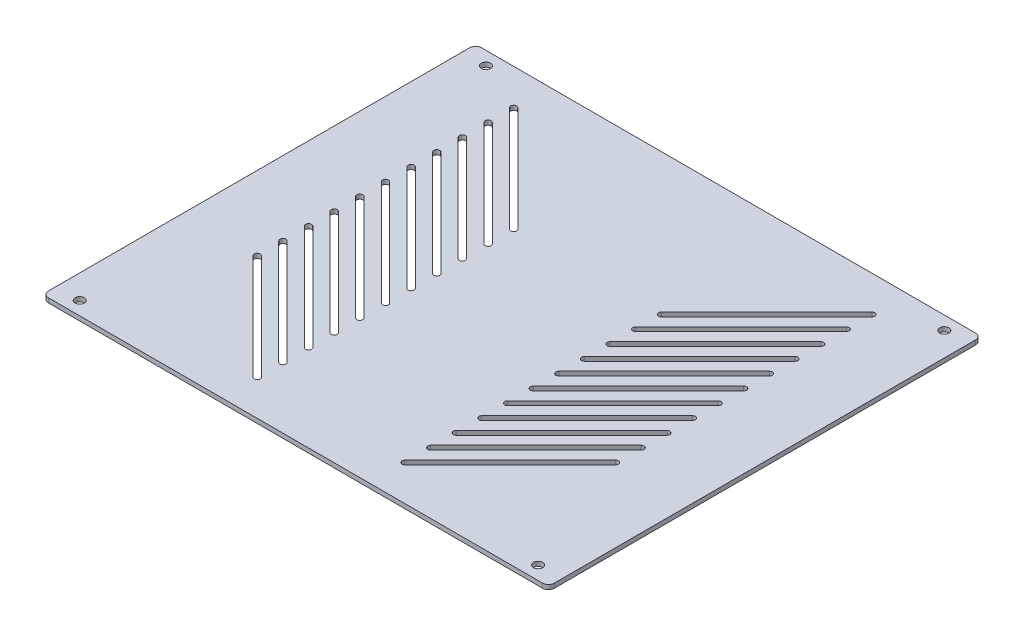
SolidWorks part; units mm, degrees
ref_plane "Front Plane" through (0, 0, 0) normal (0, 0, 1) x (1, 0, 0)
ref_plane "Top Plane" through (0, 0, 0) normal (0, 1, 0) x (1, 0, 0)
ref_plane "Right Plane" through (0, 0, 0) normal (1, 0, 0) x (0, 0, -1)
sketch "Sketch1" plane through (0, 0, 0) normal (0, 1, 0) x (1, 0, 0)
  line L1 (85, -72.75) -> (-85, -72.75)
  line L2 (85, -72.75) -> (85, 72.75)
  line L3 (85, 72.75) -> (-85, 72.75)
  line L4 (-85, -72.75) -> (-85, 72.75)
  line L5 (85, -72.75) -> (-85, 72.75) construction
  line L6 (85, 72.75) -> (-85, -72.75) construction
  line L7 (77, -68.25) -> (-77, -68.25) construction
  line L8 (77, -68.25) -> (77, 68.25) construction
  line L9 (77, 68.25) -> (-77, 68.25) construction
  line L10 (-77, -68.25) -> (-77, 68.25) construction
  line L11 (77, -68.25) -> (-77, 68.25) construction
  line L12 (77, 68.25) -> (-77, -68.25) construction
  circle A0 centre (-77, 68.25) radius 1.55
  circle A1 centre (77, 68.25) radius 1.55
  circle A2 centre (77, -68.25) radius 1.55
  circle A3 centre (-77, -68.25) radius 1.55
  point P0 (0, 0)
  point P5 (0, 0)
  dimension "D5" = 3.1
  dimension "D1" = 145.5
  dimension "D2" = 170
  dimension "D3" = 136.5
  dimension "D4" = 154
base flange "Base-Flange1" sketch "Sketch1" thickness 1.5 reverse thickness direction no parameters "D1"=1.65
fillet "Fillet1" radius 2 4 edges at (-85, -0.75, -72.75) (85, -0.75, -72.75) (-85, -0.75, 72.75) (85, -0.75, 72.75)
sketch "Sketch6" plane through (0, 0, 0) normal (0, 1, 0) x (1, 0, 0)
  line L0 (0, -72.75) -> (0, 72.75) construction
  line L1 (-83, -72.75) -> (83, -72.75) construction
  line L2 (83, 72.75) -> (-83, 72.75) construction
  line L3 (24.8223, -60.75) -> (60.1777, -25.3947) construction
  line L4 (0, -72.75) -> (85, -72.75) construction
  line L5 (85, -72.75) -> (85, 0) construction
  line L6 (85, -70.75) -> (85, 70.75) construction
  line L7 (25.5294, -61.4571) -> (60.8848, -26.1018)
  line L8 (24.1152, -60.0429) -> (59.4706, -24.6876)
  line L9 (25.5294, -52.8426) -> (60.8848, -17.4873)
  line L10 (24.1152, -51.4284) -> (59.4706, -16.0731)
  line L11 (24.8223, -52.1355) -> (60.1777, -16.7802) construction
  line L12 (25.5294, -44.2282) -> (60.8848, -8.8728)
  line L13 (24.1152, -42.814) -> (59.4706, -7.4586)
  line L14 (24.8223, -43.5211) -> (60.1777, -8.1657) construction
  line L15 (25.5294, -35.6137) -> (60.8848, -0.2584)
  line L16 (24.1152, -34.1995) -> (59.4706, 1.1558)
  line L17 (24.8223, -34.9066) -> (60.1777, 0.4487) construction
  line L18 (25.5294, -26.9992) -> (60.8848, 8.3561)
  line L19 (24.1152, -25.585) -> (59.4706, 9.7703)
  line L20 (24.8223, -26.2921) -> (60.1777, 9.0632) construction
  line L21 (25.5294, -18.3848) -> (60.8848, 16.9706)
  line L22 (24.1152, -16.9706) -> (59.4706, 18.3848)
  line L23 (24.8223, -17.6777) -> (60.1777, 17.6777) construction
  line L24 (25.5294, -9.7703) -> (60.8848, 25.585)
  line L25 (24.1152, -8.3561) -> (59.4706, 26.9992)
  line L26 (24.8223, -9.0632) -> (60.1777, 26.2921) construction
  line L27 (25.5294, -1.1558) -> (60.8848, 34.1995)
  line L28 (24.1152, 0.2584) -> (59.4706, 35.6137)
  line L29 (24.8223, -0.4487) -> (60.1777, 34.9066) construction
  line L30 (25.5294, 7.4586) -> (60.8848, 42.814)
  line L31 (24.1152, 8.8728) -> (59.4706, 44.2282)
  line L32 (24.8223, 8.1657) -> (60.1777, 43.5211) construction
  line L33 (25.5294, 16.0731) -> (60.8848, 51.4284)
  line L34 (24.1152, 17.4873) -> (59.4706, 52.8426)
  line L35 (24.8223, 16.7802) -> (60.1777, 52.1355) construction
  line L36 (25.5294, 24.6876) -> (60.8848, 60.0429)
  line L37 (24.1152, 26.1018) -> (59.4706, 61.4571)
  line L38 (24.8223, 25.3947) -> (60.1777, 60.75) construction
  line L39 (-24.8223, 25.3947) -> (-60.1777, 60.75) construction
  line L40 (-24.8223, 16.7802) -> (-60.1777, 52.1355) construction
  line L41 (-24.8223, 8.1657) -> (-60.1777, 43.5211) construction
  line L42 (-24.8223, -0.4487) -> (-60.1777, 34.9066) construction
  line L43 (-24.8223, -9.0632) -> (-60.1777, 26.2921) construction
  line L44 (-24.8223, -17.6777) -> (-60.1777, 17.6777) construction
  line L45 (-24.8223, -26.2921) -> (-60.1777, 9.0632) construction
  line L46 (-24.8223, -34.9066) -> (-60.1777, 0.4487) construction
  line L47 (-24.8223, -43.5211) -> (-60.1777, -8.1657) construction
  line L48 (-24.8223, -52.1355) -> (-60.1777, -16.7802) construction
  line L49 (-85, -72.75) -> (-85, 0) construction
  line L50 (-24.8223, -60.75) -> (-60.1777, -25.3947) construction
  line L51 (-24.1152, 26.1018) -> (-59.4706, 61.4571)
  line L52 (-25.5294, 24.6876) -> (-60.8848, 60.0429)
  line L53 (-24.1152, 17.4873) -> (-59.4706, 52.8426)
  line L54 (-25.5294, 16.0731) -> (-60.8848, 51.4284)
  line L55 (-24.1152, 8.8728) -> (-59.4706, 44.2282)
  line L56 (-25.5294, 7.4586) -> (-60.8848, 42.814)
  line L57 (-24.1152, 0.2584) -> (-59.4706, 35.6137)
  line L58 (-25.5294, -1.1558) -> (-60.8848, 34.1995)
  line L59 (-24.1152, -8.3561) -> (-59.4706, 26.9992)
  line L60 (-25.5294, -9.7703) -> (-60.8848, 25.585)
  line L61 (-24.1152, -16.9706) -> (-59.4706, 18.3848)
  line L62 (-25.5294, -18.3848) -> (-60.8848, 16.9706)
  line L63 (-24.1152, -25.585) -> (-59.4706, 9.7703)
  line L64 (-25.5294, -26.9992) -> (-60.8848, 8.3561)
  line L65 (-24.1152, -34.1995) -> (-59.4706, 1.1558)
  line L66 (-25.5294, -35.6137) -> (-60.8848, -0.2584)
  line L67 (-24.1152, -42.814) -> (-59.4706, -7.4586)
  line L68 (-25.5294, -44.2282) -> (-60.8848, -8.8728)
  line L69 (-24.1152, -51.4284) -> (-59.4706, -16.0731)
  line L70 (-25.5294, -52.8426) -> (-60.8848, -17.4873)
  line L71 (-24.1152, -60.0429) -> (-59.4706, -24.6876)
  line L72 (-25.5294, -61.4571) -> (-60.8848, -26.1018)
  arc A0 (25.5294, -61.4571) -> (24.1152, -60.0429) centre (24.8223, -60.75) cw
  arc A1 (60.8848, -26.1018) -> (59.4706, -24.6876) centre (60.1777, -25.3947) ccw
  arc A2 (25.5294, -52.8426) -> (24.1152, -51.4284) centre (24.8223, -52.1355) cw
  arc A3 (60.8848, -17.4873) -> (59.4706, -16.0731) centre (60.1777, -16.7802) ccw
  arc A4 (25.5294, -44.2282) -> (24.1152, -42.814) centre (24.8223, -43.5211) cw
  arc A5 (60.8848, -8.8728) -> (59.4706, -7.4586) centre (60.1777, -8.1657) ccw
  arc A6 (25.5294, -35.6137) -> (24.1152, -34.1995) centre (24.8223, -34.9066) cw
  arc A7 (60.8848, -0.2584) -> (59.4706, 1.1558) centre (60.1777, 0.4487) ccw
  arc A8 (25.5294, -26.9992) -> (24.1152, -25.585) centre (24.8223, -26.2921) cw
  arc A9 (60.8848, 8.3561) -> (59.4706, 9.7703) centre (60.1777, 9.0632) ccw
  arc A10 (25.5294, -18.3848) -> (24.1152, -16.9706) centre (24.8223, -17.6777) cw
  arc A11 (60.8848, 16.9706) -> (59.4706, 18.3848) centre (60.1777, 17.6777) ccw
  arc A12 (25.5294, -9.7703) -> (24.1152, -8.3561) centre (24.8223, -9.0632) cw
  arc A13 (60.8848, 25.585) -> (59.4706, 26.9992) centre (60.1777, 26.2921) ccw
  arc A14 (25.5294, -1.1558) -> (24.1152, 0.2584) centre (24.8223, -0.4487) cw
  arc A15 (60.8848, 34.1995) -> (59.4706, 35.6137) centre (60.1777, 34.9066) ccw
  arc A16 (25.5294, 7.4586) -> (24.1152, 8.8728) centre (24.8223, 8.1657) cw
  arc A17 (60.8848, 42.814) -> (59.4706, 44.2282) centre (60.1777, 43.5211) ccw
  arc A18 (25.5294, 16.0731) -> (24.1152, 17.4873) centre (24.8223, 16.7802) cw
  arc A19 (60.8848, 51.4284) -> (59.4706, 52.8426) centre (60.1777, 52.1355) ccw
  arc A20 (25.5294, 24.6876) -> (24.1152, 26.1018) centre (24.8223, 25.3947) cw
  arc A21 (60.8848, 60.0429) -> (59.4706, 61.4571) centre (60.1777, 60.75) ccw
  arc A22 (-60.8848, 60.0429) -> (-59.4706, 61.4571) centre (-60.1777, 60.75) cw
  arc A23 (-25.5294, 24.6876) -> (-24.1152, 26.1018) centre (-24.8223, 25.3947) ccw
  arc A24 (-60.8848, 51.4284) -> (-59.4706, 52.8426) centre (-60.1777, 52.1355) cw
  arc A25 (-25.5294, 16.0731) -> (-24.1152, 17.4873) centre (-24.8223, 16.7802) ccw
  arc A26 (-60.8848, 42.814) -> (-59.4706, 44.2282) centre (-60.1777, 43.5211) cw
  arc A27 (-25.5294, 7.4586) -> (-24.1152, 8.8728) centre (-24.8223, 8.1657) ccw
  arc A28 (-60.8848, 34.1995) -> (-59.4706, 35.6137) centre (-60.1777, 34.9066) cw
  arc A29 (-25.5294, -1.1558) -> (-24.1152, 0.2584) centre (-24.8223, -0.4487) ccw
  arc A30 (-60.8848, 25.585) -> (-59.4706, 26.9992) centre (-60.1777, 26.2921) cw
  arc A31 (-25.5294, -9.7703) -> (-24.1152, -8.3561) centre (-24.8223, -9.0632) ccw
  arc A32 (-60.8848, 16.9706) -> (-59.4706, 18.3848) centre (-60.1777, 17.6777) cw
  arc A33 (-25.5294, -18.3848) -> (-24.1152, -16.9706) centre (-24.8223, -17.6777) ccw
  arc A34 (-60.8848, 8.3561) -> (-59.4706, 9.7703) centre (-60.1777, 9.0632) cw
  arc A35 (-25.5294, -26.9992) -> (-24.1152, -25.585) centre (-24.8223, -26.2921) ccw
  arc A36 (-60.8848, -0.2584) -> (-59.4706, 1.1558) centre (-60.1777, 0.4487) cw
  arc A37 (-25.5294, -35.6137) -> (-24.1152, -34.1995) centre (-24.8223, -34.9066) ccw
  arc A38 (-60.8848, -8.8728) -> (-59.4706, -7.4586) centre (-60.1777, -8.1657) cw
  arc A39 (-25.5294, -44.2282) -> (-24.1152, -42.814) centre (-24.8223, -43.5211) ccw
  arc A40 (-60.8848, -17.4873) -> (-59.4706, -16.0731) centre (-60.1777, -16.7802) cw
  arc A41 (-25.5294, -52.8426) -> (-24.1152, -51.4284) centre (-24.8223, -52.1355) ccw
  arc A42 (-60.8848, -26.1018) -> (-59.4706, -24.6876) centre (-60.1777, -25.3947) cw
  arc A43 (-25.5294, -61.4571) -> (-24.1152, -60.0429) centre (-24.8223, -60.75) ccw
  point P12 (42.5, -72.75)
  point P13 (42.5, -43.0723)
  dimension "D1" = 45
  dimension "D2" = 50
  dimension "D3" = 12
  dimension "D7" = 12
  dimension "D4" = 1
  dimension "D5" = 1
  dimension "D6" = 11
extrude "Cut-Extrude1" cut sketch "Sketch6" against normal through all
sketch "Bend-Lines1" [suppressed] plane through (0, 0, 0) normal (0, 1, 0) x (1, 0, 0)
sketch "Bounding-Box1" [suppressed] plane through (0, 0, 0) normal (0, 1, 0) x (1, 0, 0)
sheet metal parameters "Sheet-Metal1" thickness 1.5 parameters "D1"=1.65
flat pattern "Flat-Pattern1"
sketch "Bend-Lines2" plane through (0, 0, 0) normal (0, 1, 0) x (1, 0, 0)
sketch3d "Bounding-Box2" [suppressed]
  line L0 (-77.5, -67.7499, 0) -> (77.5, -67.75, 0) construction
  line L1 (-77.4999, 67.75, 0) -> (77.5001, 67.7499, 0) construction
  line L2 (-77.5, -67.7499, 0) -> (-77.4999, 67.75, 0) construction
  line L3 (77.5, -67.75, 0) -> (77.5001, 67.7499, 0) construction
sheet metal parameters "Sheet-Metal2" thickness 1.5 parameters "D1"=1.65
flat pattern "Flat-Pattern1"
sketch "Bend-Lines2" plane through (0, 0, 0) normal (0, 1, 0) x (1, 0, 0)
sketch3d "Bounding-Box2" [suppressed]
  line L0 (-85, -72.7499, 0) -> (85, -72.75, 0) construction
  line L1 (-84.9999, 72.75, 0) -> (85.0001, 72.7499, 0) construction
  line L2 (-85, -72.7499, 0) -> (-84.9999, 72.75, 0) construction
  line L3 (85, -72.75, 0) -> (85.0001, 72.7499, 0) construction
